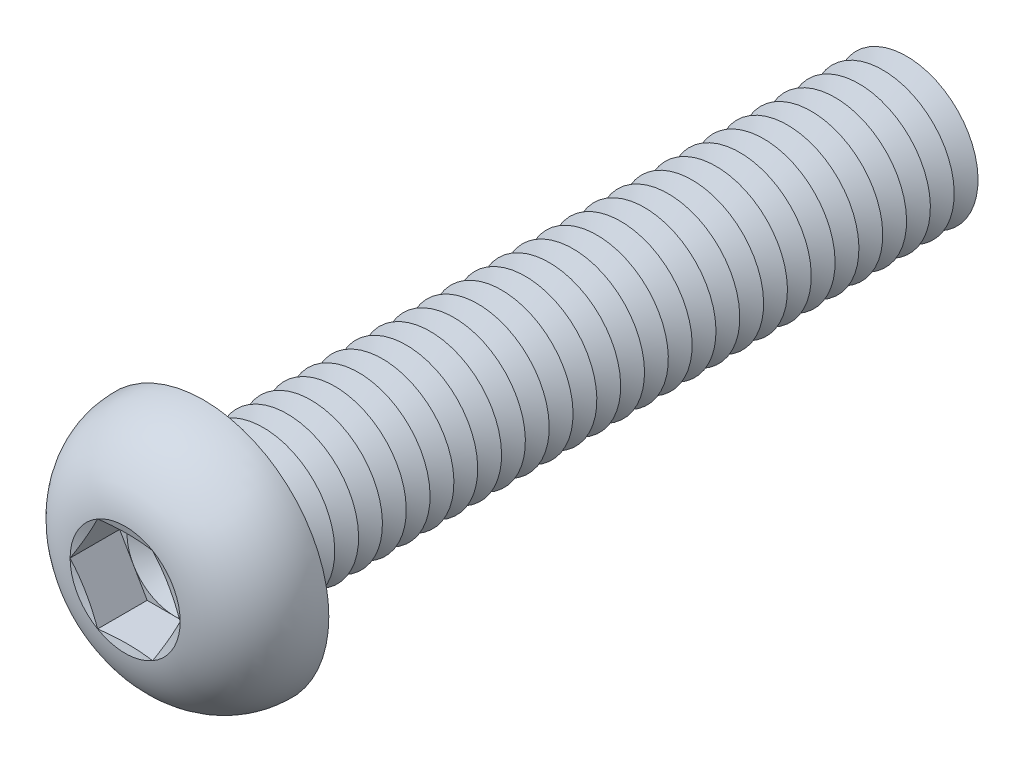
SolidWorks part; units mm, degrees
ref_plane "Front Plane" through (0, 0, 0) normal (0, 0, 1) x (1, 0, 0)
ref_plane "Top Plane" through (0, 0, 0) normal (0, 1, 0) x (1, 0, 0)
ref_plane "Right Plane" through (0, 0, 0) normal (1, 0, 0) x (0, 0, -1)
sketch "Sketch1" plane through (0, 0, 0) normal (1, 0, 0) x (0, 0, -1)
  line L0 (0, 3) -> (0, 5.25)
  line L3 (0, 3) -> (30, 3)
  line L4 (30, 3) -> (30, 0)
  line L5 (30, 0) -> (-3.3, 0) construction
  line L6 (-3.3, 0) -> (30, 0)
  line L7 (-3.3, 2.3094) -> (-3.3, 1.1547) construction
  line L8 (-3.3, 1.1547) -> (-3.3, 0)
  line L9 (-3.3, 2.3094) -> (-2.9906, 1.1547)
  line L10 (-2.9906, 1.1547) -> (-3.3, 1.1547)
  line L11 (30, 0) -> (22.7481, 0) construction
  line L12 (0, 5.25) -> (-3.3, 5.25) construction
  arc A1 (0, 5.25) -> (-3.3, 2.3094) centre (0, 1.928) ccw
  point P8 (30, 1.5)
  dimension "D1" = 10.5
  dimension "D2" = 6
  dimension "D3" = 3.3
  dimension "D4" = 4.6188
  dimension "D5" = 30
  dimension "D6" = 15
revolve "Revolve1" add sketch "Sketch1" angle 360 about L5
fillet "Fillet1" radius 0.5 1 edges at (0, 3, 0)
sketch "Sketch2" plane through (0, 0, 0) normal (1, 0, 0) x (0, 0, -1)
  line L0 (29.5, 3) -> (30.5, 3)
  line L1 (30, 3) -> (0.5, 3) construction
  line L2 (30.5, 3) -> (30, 2.134)
  line L3 (30, -3) -> (30, 3) construction
  line L4 (30, 2.134) -> (29.5, 3)
  dimension "D1" = 1
revolve "Cut-Revolve1" cut sketch "Sketch2" angle 360 about axis through (0, 0, -30) along (0, 0, -1)
pattern_linear "LPattern1" count 30 spacing 1 along (0, 0, 1) of "Cut-Revolve1"
sketch "Sketch3" plane through (0, 0, 3.3) normal (0, 0, 1) x (1, 0, 0)
  line L7 (1.1547, 2) -> (-1.1547, 2)
  line L8 (-1.1547, 2) -> (-2.3094, 0)
  line L9 (-2.3094, 0) -> (-1.1547, -2)
  line L10 (-1.1547, -2) -> (1.1547, -2)
  line L11 (1.1547, -2) -> (2.3094, 0)
  line L12 (2.3094, 0) -> (1.1547, 2)
  circle A0 centre (0, 0) radius 2 construction
  circle A3 centre (0, 0) radius 2.3094 construction
extrude "Cut-Extrude1" cut sketch "Sketch3" against normal blind 2.08
sketch "Sketch4" plane through (0, 0, 1.22) normal (0, 0, 1) x (1, 0, 0)
  line L1 (1.1547, 2) -> (-1.1547, 2) construction
  circle A0 centre (0, 0) radius 2
extrude "Cut-Extrude2" cut sketch "Sketch4" against normal through all draft 60
